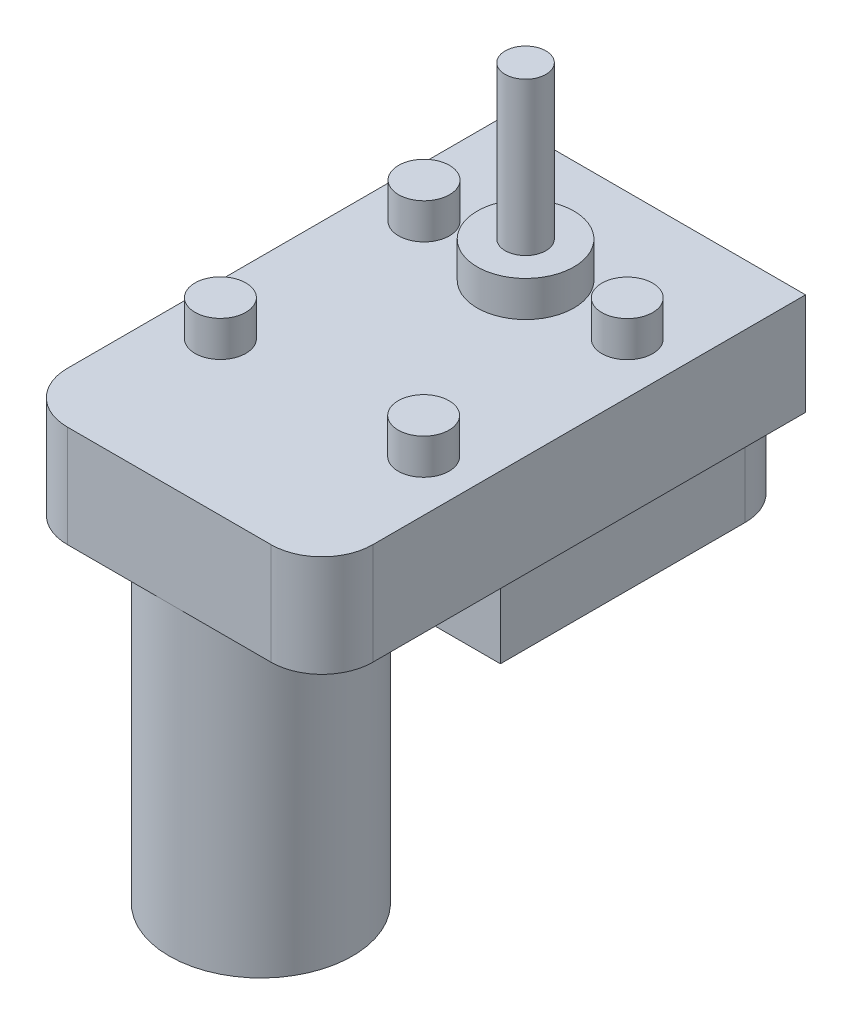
SolidWorks part; units mm, degrees
ref_plane "Front Plane" through (0, 0, 0) normal (0, 0, 1) x (1, 0, 0)
ref_plane "Top Plane" through (0, 0, 0) normal (0, 1, 0) x (1, 0, 0)
ref_plane "Right Plane" through (0, 0, 0) normal (1, 0, 0) x (0, 0, -1)
sketch "Sketch1" plane through (0, 0, 0) normal (0, 1, 0) x (1, 0, 0)
  line L1 (-25.8333, 14.1288) -> (34.1667, 14.1288)
  line L2 (-25.8333, 14.1288) -> (-25.8333, -80.8712)
  line L3 (-25.8333, -80.8712) -> (34.1667, -80.8712)
  line L4 (34.1667, 14.1288) -> (34.1667, -80.8712)
  dimension "D1" = 60
  dimension "D2" = 95
extrude "Boss-Extrude1" add sketch "Sketch1" along normal blind 20
sketch "Sketch2" plane through (0, 20, 0) normal (0, 1, 0) x (1, 0, 0)
  line L0 (4.1667, 52.9356) -> (4.1667, -106.0404) construction
  line L1 (-25.8333, 14.1288) -> (-25.8333, -80.8712) construction
  line L2 (34.1667, 14.1288) -> (-25.8333, 14.1288) construction
  line L3 (50.6379, -10.8942) -> (-64.7298, -10.8942) construction
  circle A0 centre (4.1667, -10.8712) radius 9.5
  circle A1 centre (24.1667, -10.8942) radius 5
  circle A2 centre (-15.8333, -10.8145) radius 5
  circle A3 centre (-15.8333, -50.8145) radius 5
  circle A4 centre (24.1667, -50.8942) radius 5
  dimension "D2" = 19
  dimension "D6" = 10
  dimension "D7" = 10
  dimension "D8" = 10
  dimension "D9" = 10
  dimension "D1" = 30
  dimension "D3" = 25
  dimension "D4" = 20
  dimension "D5" = 20
  dimension "D10" = 40
  dimension "D11" = 40
extrude "Boss-Extrude2" add sketch "Sketch2" along normal blind 7
sketch "Sketch3" plane through (0, 27, 0) normal (0, 1, 0) x (1, 0, 0)
  circle A0 centre (4.1667, -10.8712) radius 4
  circle A1 centre (4.1667, -10.8712) radius 9.5 construction
  dimension "D1" = 8
extrude "Boss-Extrude3" add sketch "Sketch3" along normal blind 30
sketch "Sketch4" plane through (0, 0, 0) normal (0, -1, 0) x (1, 0, 0)
  line L0 (4.1667, 99.8908) -> (4.1667, -36.1249) construction
  line L2 (-25.8333, -14.1288) -> (-25.8333, 80.8712) construction
  line L4 (-25.8333, 80.8712) -> (34.1667, 80.8712) construction
  circle A0 centre (4.1667, 62.8712) radius 18
  dimension "D2" = 36
  dimension "D1" = 30
extrude "Boss-Extrude4" add sketch "Sketch4" along normal blind 60
sketch "Sketch5" plane through (0, 0, 0) normal (0, -1, 0) x (-1, 0, 0)
  line L1 (23.9046, -44.6181) -> (-32.9703, -44.6181)
  line L2 (23.9046, -44.6181) -> (23.9046, 13.4356)
  line L3 (23.9046, 13.4356) -> (-32.9703, 13.4356)
  line L4 (-32.9703, -44.6181) -> (-32.9703, 13.4356)
extrude "Boss-Extrude5" add sketch "Sketch5" along normal blind 14
fillet "Fillet3" radius 10 2 edges at (32.9703, -7, -13.4356) (-23.9046, -7, -13.4356)
fillet "Fillet4" radius 10 2 edges at (34.1667, 10, 80.8712) (-25.8333, 10, 80.8712)
ref_plane "Plane1" through (0, 0, 81) normal (0, 0, 1) x (1, 0, 0)
